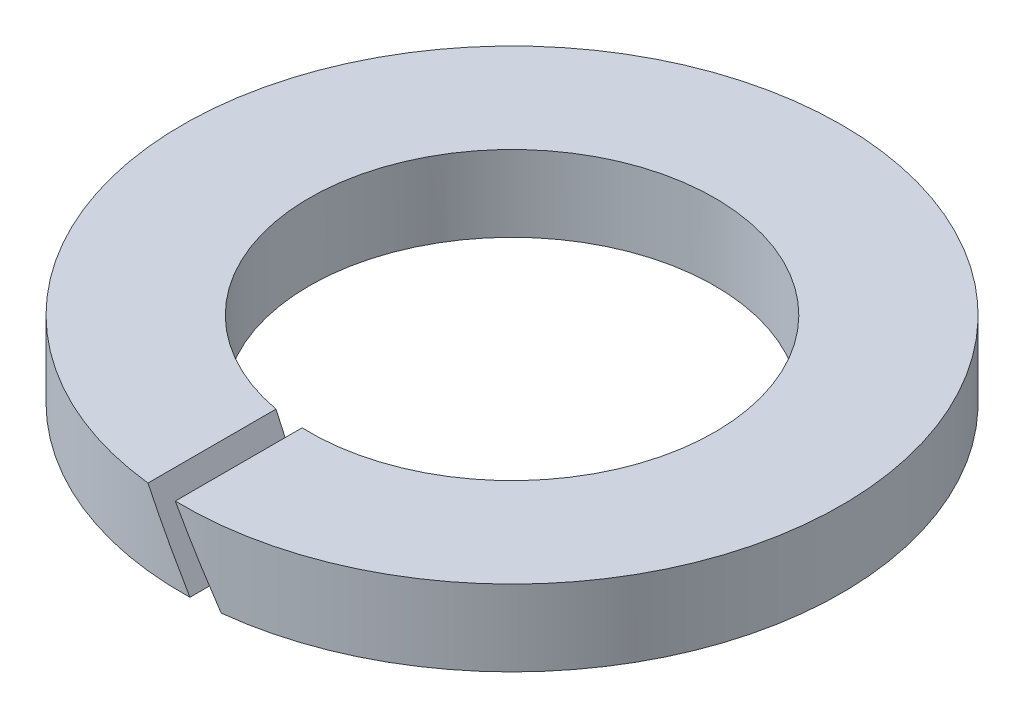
SolidWorks part; units mm, degrees
ref_plane "Base 1" through (0, 0, 0) normal (0, 0, 1) x (1, 0, 0)
ref_plane "Face" through (0, 0, 0) normal (0, 1, 0) x (1, 0, 0)
ref_plane "Base 2" through (0, 0, 0) normal (1, 0, 0) x (0, 0, -1)
sketch "section" plane through (0, 0, 0) normal (0, 0, 1) x (1, 0, 0)
  line L0 (3.2, 0.6) -> (5.2, 0.6)
  line L1 (3.2, 0.6) -> (3.2, -0.6)
  line L2 (5.2, -0.6) -> (3.2, -0.6)
  line L3 (5.2, -0.6) -> (5.2, 0.6)
  line L4 (0, 80) -> (0, -70) construction
  line L5 (5.2, 0) -> (3.2, 0) construction
  line L6 (50, 0) -> (-50, 0) construction
  dimension "A" = 6.4
  dimension "B" = 10.4
  dimension "C" = 1.2
revolve "Révolution" add sketch "section" angle 360 about L4
sketch "Sketch2" plane through (0, 0.6, 0) normal (0, 0, -1) x (-1, 0, 0)
  line L0 (1.4577, 1.9249) -> (-1.4577, -3.1249) construction
  line L1 (0, 49.4) -> (0, -50.6) construction
  line L2 (-0.5774, -1.2) -> (0.1155, 0)
  line L3 (-0.1155, -1.2) -> (0.5774, 0)
  line L4 (0.5774, 0) -> (0.1155, 0)
  line L5 (-0.1155, -1.2) -> (-0.5774, -1.2)
  line L6 (-5.2, -1.2) -> (5.2, -1.2) construction
  line L7 (-5.2, 0) -> (5.2, 0) construction
  dimension "D1" = 30
  dimension "K1" = 0.4
extrude "fente" cut sketch "Sketch2" against normal up to next
equation "\"K1@Sketch2\" = \"C@section\" / 3"
